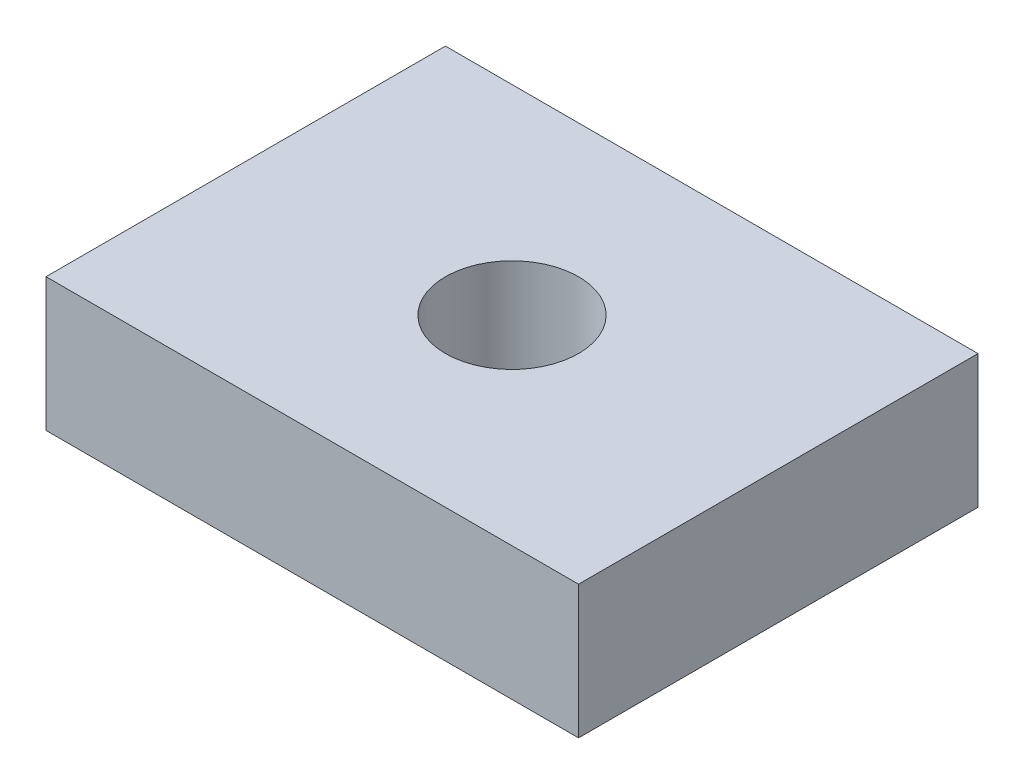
SolidWorks part; units mm, degrees
ref_plane "前视基准面" through (0, 0, 0) normal (0, 0, 1) x (1, 0, 0)
ref_plane "上视基准面" through (0, 0, 0) normal (0, 1, 0) x (1, 0, 0)
ref_plane "右视基准面" through (0, 0, 0) normal (1, 0, 0) x (0, 0, -1)
other "Configuration Table"
sketch "BaseSketch" plane through (0, 0, 0) normal (0, 1, 0) x (1, 0, 0)
  line L1 (0, 0) -> (80, 0)
  line L2 (0, 0) -> (0, 60)
  line L3 (0, 60) -> (80, 60)
  line L4 (80, 0) -> (80, 60)
  dimension "D1" = 80
  dimension "D2" = 60
extrude "BaseBoss" add sketch "BaseSketch" against normal blind 20
sketch "HoleSketch" plane through (0, 0, 0) normal (0, 1, 0) x (1, 0, 0)
  circle A0 centre (40, 30) radius 10
  dimension "D1" = 20
extrude "HoleCut" cut sketch "HoleSketch" against normal blind 20
